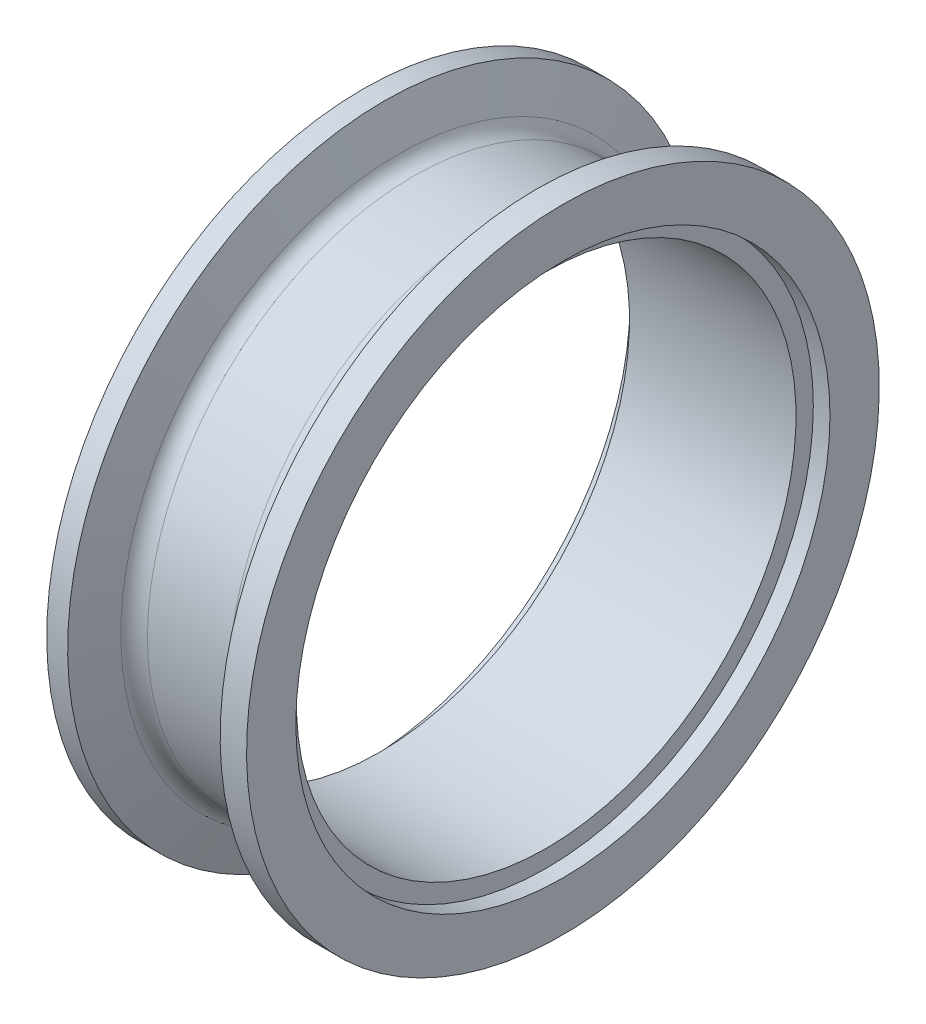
SolidWorks part; units mm, degrees
ref_plane "Front" through (0, 0, 0) normal (0, 0, 1) x (1, 0, 0)
ref_plane "Top" through (0, 0, 0) normal (0, 1, 0) x (1, 0, 0)
ref_plane "Right" through (0, 0, 0) normal (1, 0, 0) x (0, 0, -1)
sketch "Sketch1" plane through (0, 0, 0) normal (0, 0, 1) x (1, 0, 0)
  line L0 (19.05, 0) -> (0, 0) construction
  line L1 (0, 60.325) -> (0, -60.325) construction
  line L2 (0, 60.325) -> (3.9878, 60.325)
  line L3 (3.9878, 60.325) -> (6.6943, 52.8891)
  line L4 (3.175, 47.625) -> (34.925, 47.625)
  line L5 (9.6778, 50.8) -> (25.1577, 50.8)
  line L6 (3.175, 50.927) -> (0, 50.927)
  line L7 (19.05, 55.8345) -> (19.05, 31.4646) construction
  line L8 (34.925, 50.927) -> (34.925, 47.625)
  line L10 (38.1, 60.325) -> (38.1, 50.927)
  line L11 (34.925, 50.927) -> (38.1, 50.927)
  line L12 (0, 60.325) -> (0, 50.927)
  line L13 (33.0708, 60.325) -> (31.1247, 54.9782)
  line L14 (38.1, 60.325) -> (33.0708, 60.325)
  line L15 (3.175, 50.927) -> (3.175, 47.625)
  arc A0 (6.6943, 52.8891) -> (9.6778, 50.8) centre (9.6778, 53.975) ccw
  arc A2 (31.1247, 54.9782) -> (25.1577, 50.8) centre (25.1577, 57.15) cw
  point P20 (7.4546, 50.8)
  dimension "D7" = 3.175
  dimension "D10" = 6.35
  dimension "D2" = 3.175
  dimension "D3" = 38.1
  dimension "D4" = 101.6
  dimension "D5" = 3.175
  dimension "D6" = 101.854
  dimension "D8" = 5.0292
  dimension "D9" = 70
  dimension "D13" = 120.65
  dimension "D15" = 3.9878
  dimension "D16" = 70
revolve "Revolve1" add sketch "Sketch1" angle 360 about L0
